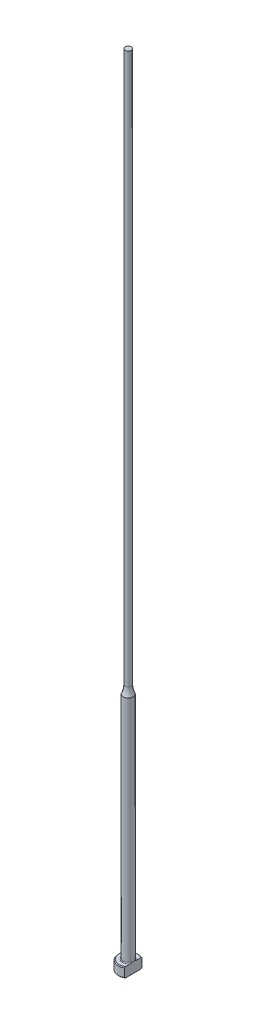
SolidWorks part; units mm, degrees
ref_plane "Front Plane" through (0, 0, 0) normal (0, 0, 1) x (1, 0, 0)
ref_plane "Top Plane" through (0, 0, 0) normal (0, 1, 0) x (1, 0, 0)
ref_plane "Right Plane" through (0, 0, 0) normal (1, 0, 0) x (0, 0, -1)
sketch "Sketch1" plane through (0, 0, 0) normal (0, 0, 1) x (1, 0, 0)
  line L0 (0, 259.9588) -> (0, -15.1925) construction
  line L1 (0, 0) -> (-3.175, 0)
  line L2 (-3.175, 0) -> (-3.175, 3.175)
  line L3 (-3.175, 3.175) -> (-1.5875, 3.175)
  line L4 (-0.9919, 78.8851) -> (-0.9919, 254)
  line L5 (-0.9919, 254) -> (0, 254)
  line L6 (0, 254) -> (0, 0)
  line L7 (-1.5875, 3.175) -> (-1.5875, 76.2)
  arc A0 (-1.5875, 76.2) -> (-0.9919, 78.8851) centre (-7.3419, 78.8851) ccw
  point P13 (-1.5875, 0)
  dimension "D1" = 6.35
  dimension "L" = 254
  dimension "D2" = 3.175
  dimension "H" = 6.35
  dimension "T" = 3.175
  dimension "D" = 1.9837
  dimension "S" = 76.2
revolve "Revolve1" add sketch "Sketch1" angle 360 about L0
chamfer "Chamfer1" distance 0.254 angle 45 2 edges at (0, 3.175, 3.175) (0, 0, 3.175)
fillet "Fillet1" radius 0.254 1 edges at (0, 3.175, 1.5875)
sketch "Sketch2" plane through (0, 0, 0) normal (0, 1, 0) x (1, 0, 0)
  line L0 (1.5875, -2.7496) -> (1.5875, 2.7496)
  circle A0 centre (0, 0) radius 3.175 construction
  arc A2 (1.5875, -2.7496) -> (1.5875, 2.7496) centre (0, 0) ccw
  circle A3 centre (0, 0) radius 3.175 construction
  circle A4 centre (0, 0) radius 1.5875 construction
extrude "Key Head" cut sketch "Sketch2" along normal up to next
